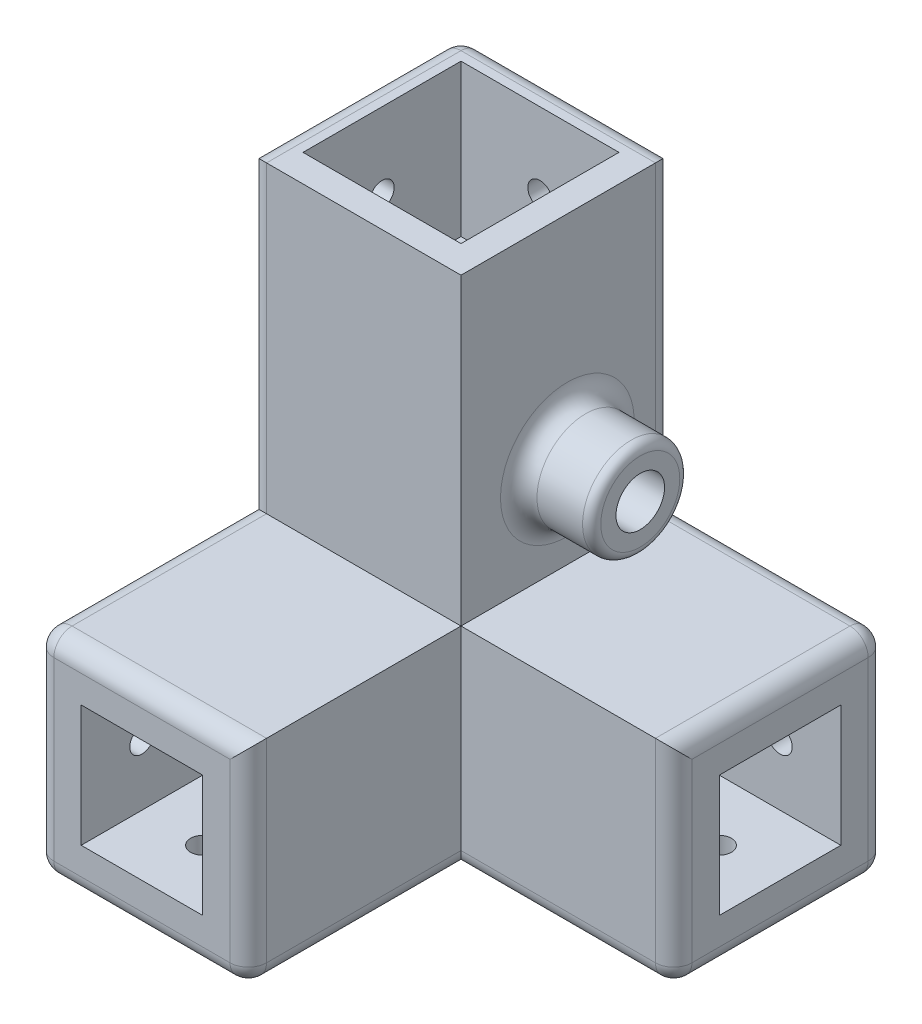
SolidWorks part; units mm, degrees
ref_plane "Alzado" through (0, 0, 0) normal (0, 0, 1) x (1, 0, 0)
ref_plane "Planta" through (0, 0, 0) normal (0, 1, 0) x (1, 0, 0)
ref_plane "Vista lateral" through (0, 0, 0) normal (1, 0, 0) x (0, 0, -1)
sketch "Sketch1" plane through (0, 0, 0) normal (0, 0, 1) x (1, 0, 0)
  line L0 (0, 85) -> (0, 0)
  line L1 (0, 0) -> (70, 0)
  line L2 (70, 0) -> (70, 35)
  line L3 (70, 35) -> (35, 35)
  line L4 (35, 35) -> (35, 85)
  line L5 (35, 85) -> (0, 85)
  dimension "D1" = 85
  dimension "D2" = 70
  dimension "D3" = 35
  dimension "D4" = 35
extrude "Boss-Extrude1" add sketch "Sketch1" along normal blind 35
sketch "Sketch4" plane through (70, 0, 0) normal (1, 0, 0) x (0, 0, -1)
  line L0 (0, 0) -> (0, 35) construction
  line L1 (-27.5, 27.5) -> (-7.5, 27.5)
  line L2 (-27.5, 27.5) -> (-27.5, 7.5)
  line L3 (-27.5, 7.5) -> (-7.5, 7.5)
  line L4 (-7.5, 27.5) -> (-7.5, 7.5)
  line L5 (-27.5, 27.5) -> (-7.5, 7.5) construction
  line L6 (-27.5, 7.5) -> (-7.5, 27.5) construction
  line L7 (-35, 0) -> (0, 0) construction
  point P0 (-17.5, 17.5)
  dimension "D1" = 20
  dimension "D2" = 20
  dimension "D3" = 17.5
  dimension "D4" = 17.5
sketch "Sketch5" plane through (0, 85, 0) normal (0, 1, 0) x (1, 0, 0)
  line L0 (35, 0) -> (0, 0) construction
  line L1 (4.5, -4.5) -> (30.5, -4.5)
  line L2 (4.5, -4.5) -> (4.5, -30.5)
  line L3 (4.5, -30.5) -> (30.5, -30.5)
  line L4 (30.5, -4.5) -> (30.5, -30.5)
  line L5 (4.5, -4.5) -> (30.5, -30.5) construction
  line L6 (4.5, -30.5) -> (30.5, -4.5) construction
  line L7 (35, -35) -> (35, 0) construction
  point P0 (17.5, -17.5)
  dimension "D1" = 26
  dimension "D2" = 26
  dimension "D3" = 17.5
  dimension "D4" = 17.5
sketch "Sketch8" plane through (0, 0, 35) normal (0, 0, 1) x (1, 0, 0)
  line L1 (0, 0) -> (35, 0)
  line L2 (0, 0) -> (0, 35)
  line L3 (0, 35) -> (35, 35)
  line L4 (35, 0) -> (35, 35)
extrude "Boss-Extrude2" add sketch "Sketch8" along normal blind 35
sketch "Sketch9" plane through (0, 0, 70) normal (0, 0, 1) x (1, 0, 0)
  line L0 (0, 35) -> (0, 0) construction
  line L1 (7.5, 27.5) -> (27.5, 27.5)
  line L2 (7.5, 27.5) -> (7.5, 7.5)
  line L3 (7.5, 7.5) -> (27.5, 7.5)
  line L4 (27.5, 27.5) -> (27.5, 7.5)
  line L5 (7.5, 27.5) -> (27.5, 7.5) construction
  line L6 (7.5, 7.5) -> (27.5, 27.5) construction
  line L8 (0, 0) -> (35, 0) construction
  point P0 (17.5, 17.5)
  dimension "D1" = 20
  dimension "D2" = 20
  dimension "D3" = 17.5
  dimension "D4" = 17.5
extrude "Cut-Extrude1" cut sketch "Sketch9" against normal blind 20
extrude "Cut-Extrude2" cut sketch "Sketch4" against normal blind 20
sketch "Sketch10" plane through (35, 0, 0) normal (1, 0, 0) x (0, 0, -1)
  line L0 (-35, 35) -> (-35, 85) construction
  line L1 (-4.5, 85) -> (-30.5, 85) construction
  circle A0 centre (-17.5, 50) radius 8
  dimension "D1" = 16
  dimension "D2" = 17.5
  dimension "D3" = 35
extrude "Boss-Extrude3" add sketch "Sketch10" along normal blind 12
sketch "Sketch11" plane through (47, 0, 0) normal (1, 0, 0) x (0, 0, -1)
  circle A0 centre (-17.5, 50) radius 4
  dimension "D1" = 8
extrude "Cut-Extrude3" cut sketch "Sketch11" against normal blind 25
extrude "Cut-Extrude4" cut sketch "Sketch5" against normal blind 25
sketch "Sketch12" plane through (0, 0, 0) normal (-1, 0, 0) x (0, 0, 1)
  line L0 (0, 85) -> (0, 0) construction
  line L1 (35, 85) -> (0, 85) construction
  line L2 (70, 35) -> (70, 0) construction
  line L3 (70, 35) -> (35, 35) construction
  circle A0 centre (17.5, 72.5) radius 2
  circle A1 centre (60, 17.5) radius 2
  dimension "D1" = 4
  dimension "D2" = 4
  dimension "D3" = 17.5
  dimension "D4" = 12.5
  dimension "D5" = 10
  dimension "D6" = 17.5
extrude "Cut-Extrude5" cut sketch "Sketch12" against normal blind 10
sketch "Sketch13" plane through (0, 0, 0) normal (0, 0, -1) x (-1, 0, 0)
  line L0 (-70, 0) -> (-70, 35) construction
  line L1 (-35, 35) -> (-35, 85) construction
  line L2 (-35, 85) -> (0, 85) construction
  line L3 (-70, 35) -> (-35, 35) construction
  circle A0 centre (-17.5, 72.5) radius 2
  circle A1 centre (-60, 17.5) radius 2
  point P10 (-15.2676, 75.4619)
  point P11 (-17.7303, 73.9374)
  point P12 (0, 0)
  dimension "D1" = 4
  dimension "D2" = 4
  dimension "D3" = 10
  dimension "D4" = 17.5
  dimension "D5" = 12.5
  dimension "D6" = 17.5
extrude "Cut-Extrude6" cut sketch "Sketch13" against normal blind 10
sketch "Sketch14" plane through (0, 0, 0) normal (0, -1, 0) x (1, 0, 0)
  line L0 (0, 70) -> (35, 70) construction
  line L3 (70, 35) -> (70, 0) construction
  line L4 (0, 0) -> (70, 0) construction
  line L5 (35, 70) -> (35, 35) construction
  circle A0 centre (17.5, 60) radius 2
  circle A1 centre (60, 17.5) radius 2
  point P10 (71.0942, 27.5424)
  dimension "D5" = 4
  dimension "D6" = 4
  dimension "D1" = 10
  dimension "D2" = 10
  dimension "D3" = 17.5
  dimension "D4" = 17.5
extrude "Cut-Extrude7" cut sketch "Sketch14" against normal blind 10
fillet "Fillet1" radius 3 19 edges at (17.5, 85, 0) (17.5, 0, 70) (17.5, 35, 70) (35, 17.5, 70) (35, 0, 52.5) (52.5, 0, 35) (70, 17.5, 35) (70, 35, 17.5) (70, 0, 17.5) (35, 0, 0) (70, 17.5, 0) (52.5, 35, 0) (35, 60, 0) (0, 85, 17.5) (0, 42.5, 0) (0, 60, 35) (0, 35, 52.5) (0, 17.5, 70) (0, 0, 35)
fillet "Fillet2" radius 3 1 edges at (35, 50, 25.5)
fillet "Fillet3" radius 1.5 1 edges at (47, 50, 9.5)
